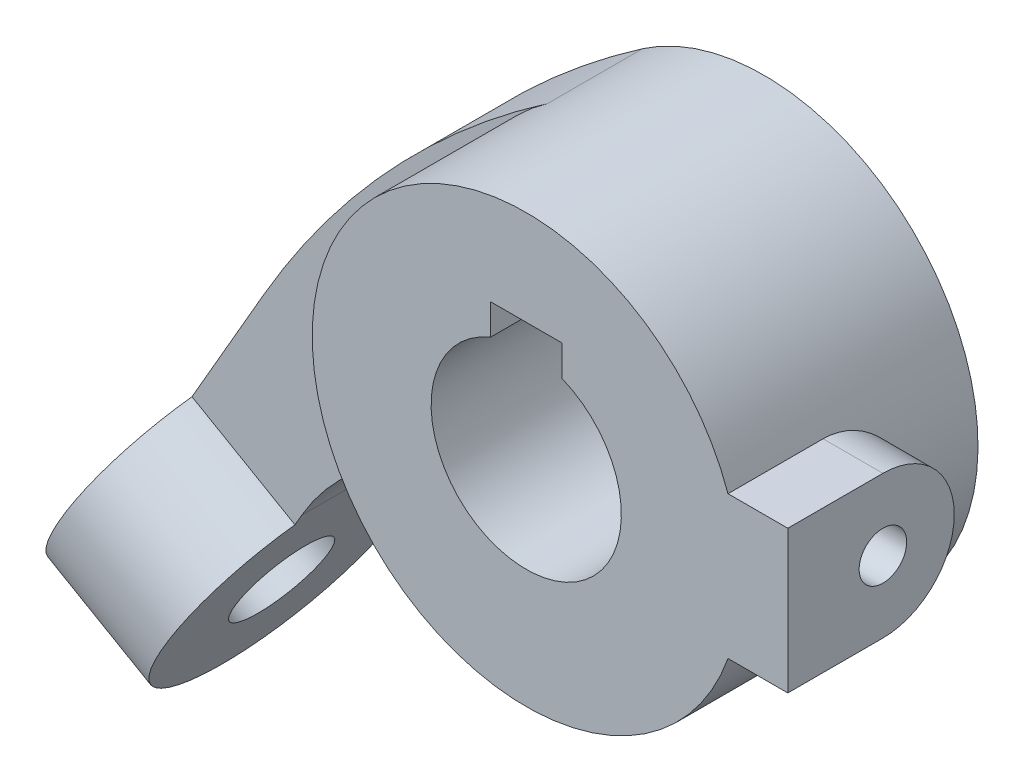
SolidWorks part; units mm, degrees
ref_plane "前视基准面" through (0, 0, 0) normal (0, 0, 1) x (1, 0, 0)
ref_plane "上视基准面" through (0, 0, 0) normal (0, 1, 0) x (1, 0, 0)
ref_plane "右视基准面" through (0, 0, 0) normal (1, 0, 0) x (0, 0, -1)
sketch "草图1" plane through (0, 0, 0) normal (0, 0, 1) x (1, 0, 0)
  line L0 (0, 11.715) -> (0, -12.6704) construction
  line L1 (-12.634, 0) -> (12.1078, 0) construction
  line L2 (-3, 7.4162) -> (-3, 10)
  line L3 (-3, 10) -> (3, 10)
  line L4 (3, 7.4162) -> (3, 10)
  arc A0 (-3, 7.4162) -> (3, 7.4162) centre (0, 0) ccw
  circle A1 centre (0, 0) radius 18
  point P13 (0, 10)
  dimension "D1" = 36
  dimension "D2" = 16
  dimension "D4" = 10
  dimension "D3" = 6
extrude "凸台-拉伸1" add sketch "草图1" along normal blind 20
ref_plane "基准面1" through (22, 0, 0) normal (1, 0, 0) x (0, 0, -1)
sketch "草图2" plane through (22, 0, 0) normal (1, 0, 0) x (0, 0, -1)
  line L0 (-24.8754, 0) -> (-6.9723, 0) construction
  line L1 (-12, 6.7466) -> (-12, -9.8402) construction
  line L2 (-20, 18) -> (-20, -18) construction
  line L3 (-12, 6) -> (-20, 6)
  line L4 (-12, -6) -> (-20, -6)
  line L5 (-20, 6) -> (-20, -6)
  circle A0 centre (-12, 0) radius 2
  arc A1 (-12, -6) -> (-12, 6) centre (-12, 0) ccw
  dimension "D1" = 6
  dimension "D2" = 4
  dimension "D3" = 8
extrude "凸台-拉伸2" add sketch "草图2" against normal up to next
sketch "草图3" plane through (0, 0, 0) normal (0, 0, 1) x (1, 0, 0)
  line L0 (-34.0887, -11.0434) -> (-44.7846, -29.5692)
  line L1 (-30.886, -25.4962) -> (-36.1244, -34.5692)
  line L2 (-64.6804, -18.0824) -> (-14.5619, -47.0183) construction
  line L3 (0, 0) -> (-40.1698, -69.5762) construction
  line L4 (0, 0) -> (-50.4077, 29.1029) construction
  line L5 (-44.7846, -29.5692) -> (-36.1244, -34.5692)
  arc A0 (-10.2174, 14.8191) -> (-6.4258, -16.814) centre (0, 0) ccw
  arc A1 (-6.4258, -16.814) -> (-30.886, -25.4962) centre (-13.5655, -35.4962) ccw
  arc A2 (-10.2174, 14.8191) -> (-34.0887, -11.0434) centre (35.1933, -51.0434) ccw
  dimension "D4" = 40
  dimension "D5" = 36
  dimension "D6" = 160
  dimension "D1" = 48
  dimension "D2" = 24
  dimension "D3" = 14
extrude "凸台-拉伸3" add sketch "草图3" along normal blind 8
ref_plane "基准面2" through (-20.7846, 12, 0) normal (-0.866, 0.5, 0) x (0, 0, 1)
sketch "草图4" plane through (-20.7846, 12, 0) normal (-0.866, 0.5, 0) x (0, 0, 1)
  line L0 (-10.5902, -48) -> (19.4775, -48) construction
  line L1 (4.4436, -35.1861) -> (4.4436, -67.7123) construction
  circle A1 centre (4.4436, -48) radius 10
  dimension "D2" = 20
extrude "凸台-拉伸4" add sketch "草图4" against normal blind 10
sketch "草图5" plane through (-20.7846, 12, 0) normal (-0.866, 0.5, 0) x (0, 0, 1)
  circle A0 centre (4.4436, -48) radius 4
  dimension "D1" = 8
extrude "切除-拉伸1" cut sketch "草图5" against normal blind 11
